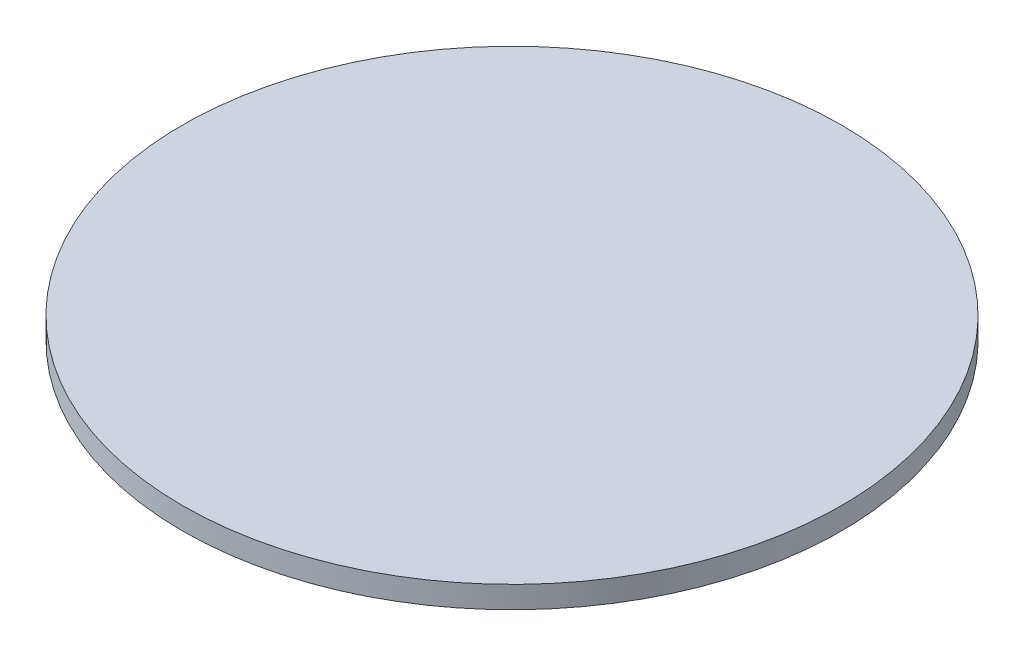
SolidWorks part; units mm, degrees
ref_plane "Front Plane" through (0, 0, 0) normal (0, 0, 1) x (1, 0, 0)
ref_plane "Top Plane" through (0, 0, 0) normal (0, 1, 0) x (1, 0, 0)
ref_plane "Right Plane" through (0, 0, 0) normal (1, 0, 0) x (0, 0, -1)
sketch "Sketch1" plane through (0, 0, 0) normal (0, 1, 0) x (1, 0, 0)
  circle A0 centre (0, 0) radius 225
  dimension "D1" = 225
extrude "Boss-Extrude1" add sketch "Sketch1" along normal blind 15 contours A0
